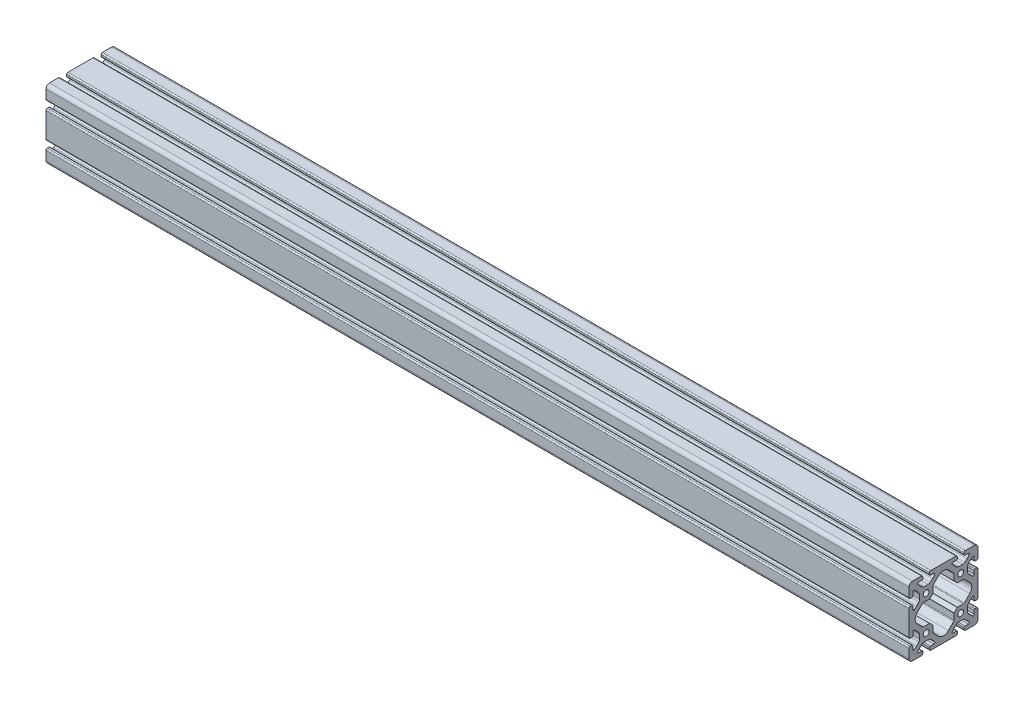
SolidWorks part; units mm, degrees
ref_plane "Ebene vorne" through (0, 0, 0) normal (0, 0, 1) x (1, 0, 0)
ref_plane "Ebene oben" through (0, 0, 0) normal (0, 1, 0) x (1, 0, 0)
ref_plane "Ebene rechts" through (0, 0, 0) normal (1, 0, 0) x (0, 0, -1)
sketch "Skizze1" plane through (0, 0, 0) normal (0, 1, 0) x (1, 0, 0)
  line L0 (0, 0) -> (1000, 0)
  dimension "D1" = 1000
other "Strukturbauteil1"
ref_plane "Ebene1" through (0, 0, 0) normal (1, 0, 0) x (0, 0, -1)
sketch "Model" plane through (0, 0, 0) normal (1, 0, 0) x (0, 0, -1)
  line L0 (-40, -25.5) -> (-40, -36)
  line L1 (-36, -40) -> (-25.5, -40)
  line L2 (-24, -38.5) -> (-24, -36.5)
  line L3 (-25, -35.5) -> (-28.9161, -35.5)
  line L4 (-22.1931, -27.75) -> (-17.8069, -27.75)
  line L5 (-11.0839, -35.5) -> (-15, -35.5)
  line L6 (-16, -36.5) -> (-16, -38.5)
  line L7 (-14.5, -40) -> (14.5, -40)
  line L8 (16, -38.5) -> (16, -36.5)
  line L9 (15, -35.5) -> (11.0839, -35.5)
  line L10 (17.8069, -27.75) -> (22.1931, -27.75)
  line L11 (28.9161, -35.5) -> (25, -35.5)
  line L12 (24, -36.5) -> (24, -38.5)
  line L13 (25.5, -40) -> (36, -40)
  line L14 (40, -36) -> (40, -25.5)
  line L15 (38.5, -24) -> (36.5, -24)
  line L16 (35.5, -25) -> (35.5, -28.9161)
  line L17 (27.75, -22.1931) -> (27.75, -17.8069)
  line L18 (35.5, -11.0839) -> (35.5, -15)
  line L19 (36.5, -16) -> (38.5, -16)
  line L20 (40, -14.5) -> (40, 14.5)
  line L21 (38.5, 16) -> (36.5, 16)
  line L22 (35.5, 15) -> (35.5, 11.0839)
  line L23 (27.75, 17.8069) -> (27.75, 22.1931)
  line L24 (35.5, 28.9161) -> (35.5, 25)
  line L25 (36.5, 24) -> (38.5, 24)
  line L26 (40, 25.5) -> (40, 36)
  line L27 (36, 40) -> (25.5, 40)
  line L28 (24, 38.5) -> (24, 36.5)
  line L29 (25, 35.5) -> (28.9161, 35.5)
  line L30 (22.1931, 27.75) -> (17.8069, 27.75)
  line L31 (11.0839, 35.5) -> (15, 35.5)
  line L32 (16, 36.5) -> (16, 38.5)
  line L33 (14.5, 40) -> (-14.5, 40)
  line L34 (-16, 38.5) -> (-16, 36.5)
  line L35 (-15, 35.5) -> (-11.0839, 35.5)
  line L36 (-17.8069, 27.75) -> (-22.1931, 27.75)
  line L37 (-28.9161, 35.5) -> (-25, 35.5)
  line L38 (-24, 36.5) -> (-24, 38.5)
  line L39 (-25.5, 40) -> (-36, 40)
  line L40 (-40, 36) -> (-40, 25.5)
  line L41 (-38.5, 24) -> (-36.5, 24)
  line L42 (-35.5, 25) -> (-35.5, 28.9161)
  line L43 (-27.75, 22.1931) -> (-27.75, 17.8069)
  line L44 (-35.5, 11.0839) -> (-35.5, 15)
  line L45 (-36.5, 16) -> (-38.5, 16)
  line L46 (-40, 14.5) -> (-40, -14.5)
  line L47 (-38.5, -16) -> (-36.5, -16)
  line L48 (-35.5, -15) -> (-35.5, -11.0839)
  line L49 (-27.75, -17.8069) -> (-27.75, -22.1931)
  line L50 (-35.5, -28.9161) -> (-35.5, -25)
  line L51 (-36.5, -24) -> (-38.5, -24)
  line L52 (-24.307, 11.8107) -> (-30.4608, 5.6569)
  line L53 (-30.4608, -5.6569) -> (-24.307, -11.8107)
  line L54 (-23.2463, -12.25) -> (-16.1585, -12.25)
  line L55 (-15.9464, -12.3379) -> (-12.3379, -15.9464)
  line L56 (-12.25, -16.1585) -> (-12.25, -23.2463)
  line L57 (-11.8107, -24.307) -> (-5.6569, -30.4608)
  line L58 (5.6569, -30.4608) -> (11.8107, -24.307)
  line L59 (12.25, -23.2463) -> (12.25, -16.1585)
  line L60 (12.3379, -15.9464) -> (15.9464, -12.3379)
  line L61 (16.1585, -12.25) -> (23.2463, -12.25)
  line L62 (24.307, -11.8107) -> (30.4608, -5.6569)
  line L63 (30.4608, 5.6569) -> (24.307, 11.8107)
  line L64 (23.2463, 12.25) -> (16.1585, 12.25)
  line L65 (15.9464, 12.3379) -> (12.3379, 15.9464)
  line L66 (12.25, 16.1585) -> (12.25, 23.2463)
  line L67 (11.8107, 24.307) -> (5.6569, 30.4608)
  line L68 (-5.6569, 30.4608) -> (-11.8107, 24.307)
  line L69 (-12.25, 23.2463) -> (-12.25, 16.1585)
  line L70 (-12.3379, 15.9464) -> (-15.9464, 12.3379)
  line L71 (-16.1585, 12.25) -> (-23.2463, 12.25)
  line L72 (-29.7888, 33.7733) -> (-27.3788, 30.9636)
  line L73 (-40, -40) -> (40, -40) construction
  line L74 (-40, -40) -> (-40, 40) construction
  line L75 (-40, 40) -> (40, 40) construction
  line L76 (40, -40) -> (40, 40) construction
  line L77 (-40, -40) -> (40, 40) construction
  line L78 (-40, 40) -> (40, -40) construction
  line L79 (-27.3788, 30.9636) -> (-24.5803, 28.5405)
  line L80 (-15.4197, 28.5405) -> (-12.6212, 30.9636)
  line L81 (-12.6212, 30.9636) -> (-10.2112, 33.7733)
  line L82 (-33.7733, 29.7888) -> (-30.9636, 27.3788)
  line L83 (-30.9636, 27.3788) -> (-28.5405, 24.5803)
  line L84 (10.2112, 33.7733) -> (12.6212, 30.9636)
  line L85 (12.6212, 30.9636) -> (15.4197, 28.5405)
  line L86 (24.5803, 28.5405) -> (27.3788, 30.9636)
  line L87 (27.3788, 30.9636) -> (29.7888, 33.7733)
  line L88 (33.7733, 29.7888) -> (30.9636, 27.3788)
  line L89 (30.9636, 27.3788) -> (28.5405, 24.5803)
  line L90 (28.5405, 15.4197) -> (30.9636, 12.6212)
  line L91 (30.9636, 12.6212) -> (33.7733, 10.2112)
  line L92 (33.7733, -10.2112) -> (30.9636, -12.6212)
  line L93 (30.9636, -12.6212) -> (28.5405, -15.4197)
  line L94 (28.5405, -24.5803) -> (30.9636, -27.3788)
  line L95 (30.9636, -27.3788) -> (33.7733, -29.7888)
  line L96 (29.7888, -33.7733) -> (27.3788, -30.9636)
  line L97 (27.3788, -30.9636) -> (24.5803, -28.5405)
  line L98 (15.4197, -28.5405) -> (12.6212, -30.9636)
  line L99 (12.6212, -30.9636) -> (10.2112, -33.7733)
  line L100 (-10.2112, -33.7733) -> (-12.6212, -30.9636)
  line L101 (-12.6212, -30.9636) -> (-15.4197, -28.5405)
  line L102 (-24.5803, -28.5405) -> (-27.3788, -30.9636)
  line L103 (-27.3788, -30.9636) -> (-29.7888, -33.7733)
  line L104 (-33.7733, -29.7888) -> (-30.9636, -27.3788)
  line L105 (-30.9636, -27.3788) -> (-28.5405, -24.5803)
  line L106 (-28.5405, -15.4197) -> (-30.9636, -12.6212)
  line L107 (-30.9636, -12.6212) -> (-33.7733, -10.2112)
  line L108 (-33.7733, 10.2112) -> (-30.9636, 12.6212)
  line L109 (-30.9636, 12.6212) -> (-28.5405, 15.4197)
  circle A0 centre (-20, -20) radius 3.4
  circle A1 centre (20, -20) radius 3.4
  circle A2 centre (-20, 20) radius 3.4
  circle A3 centre (20, 20) radius 3.4
  arc A4 (-40, -36) -> (-36, -40) centre (-36, -36) ccw
  arc A5 (-25.5, -40) -> (-24, -38.5) centre (-25.5, -38.5) ccw
  arc A6 (-24, -36.5) -> (-25, -35.5) centre (-25, -36.5) ccw
  arc A7 (-29.7888, -33.7733) -> (-28.9161, -35.5) centre (-28.9161, -34.4161) ccw
  arc A9 (-22.1931, -27.75) -> (-24.5803, -28.5405) centre (-22.1931, -31.75) ccw
  arc A10 (-15.4197, -28.5405) -> (-17.8069, -27.75) centre (-17.8069, -31.75) ccw
  arc A12 (-11.0839, -35.5) -> (-10.2112, -33.7733) centre (-11.0839, -34.4161) ccw
  arc A13 (-15, -35.5) -> (-16, -36.5) centre (-15, -36.5) ccw
  arc A14 (-16, -38.5) -> (-14.5, -40) centre (-14.5, -38.5) ccw
  arc A15 (14.5, -40) -> (16, -38.5) centre (14.5, -38.5) ccw
  arc A16 (16, -36.5) -> (15, -35.5) centre (15, -36.5) ccw
  arc A17 (10.2112, -33.7733) -> (11.0839, -35.5) centre (11.0839, -34.4161) ccw
  arc A19 (17.8069, -27.75) -> (15.4197, -28.5405) centre (17.8069, -31.75) ccw
  arc A20 (24.5803, -28.5405) -> (22.1931, -27.75) centre (22.1931, -31.75) ccw
  arc A22 (28.9161, -35.5) -> (29.7888, -33.7733) centre (28.9161, -34.4161) ccw
  arc A23 (25, -35.5) -> (24, -36.5) centre (25, -36.5) ccw
  arc A24 (24, -38.5) -> (25.5, -40) centre (25.5, -38.5) ccw
  arc A25 (36, -40) -> (40, -36) centre (36, -36) ccw
  arc A26 (40, -25.5) -> (38.5, -24) centre (38.5, -25.5) ccw
  arc A27 (36.5, -24) -> (35.5, -25) centre (36.5, -25) ccw
  arc A28 (33.7733, -29.7888) -> (35.5, -28.9161) centre (34.4161, -28.9161) ccw
  arc A30 (27.75, -22.1931) -> (28.5405, -24.5803) centre (31.75, -22.1931) ccw
  arc A31 (28.5405, -15.4197) -> (27.75, -17.8069) centre (31.75, -17.8069) ccw
  arc A33 (35.5, -11.0839) -> (33.7733, -10.2112) centre (34.4161, -11.0839) ccw
  arc A34 (35.5, -15) -> (36.5, -16) centre (36.5, -15) ccw
  arc A35 (38.5, -16) -> (40, -14.5) centre (38.5, -14.5) ccw
  arc A36 (40, 14.5) -> (38.5, 16) centre (38.5, 14.5) ccw
  arc A37 (36.5, 16) -> (35.5, 15) centre (36.5, 15) ccw
  arc A38 (33.7733, 10.2112) -> (35.5, 11.0839) centre (34.4161, 11.0839) ccw
  arc A40 (27.75, 17.8069) -> (28.5405, 15.4197) centre (31.75, 17.8069) ccw
  arc A41 (28.5405, 24.5803) -> (27.75, 22.1931) centre (31.75, 22.1931) ccw
  arc A43 (35.5, 28.9161) -> (33.7733, 29.7888) centre (34.4161, 28.9161) ccw
  arc A44 (35.5, 25) -> (36.5, 24) centre (36.5, 25) ccw
  arc A45 (38.5, 24) -> (40, 25.5) centre (38.5, 25.5) ccw
  arc A46 (40, 36) -> (36, 40) centre (36, 36) ccw
  arc A47 (25.5, 40) -> (24, 38.5) centre (25.5, 38.5) ccw
  arc A48 (24, 36.5) -> (25, 35.5) centre (25, 36.5) ccw
  arc A49 (29.7888, 33.7733) -> (28.9161, 35.5) centre (28.9161, 34.4161) ccw
  arc A51 (22.1931, 27.75) -> (24.5803, 28.5405) centre (22.1931, 31.75) ccw
  arc A52 (15.4197, 28.5405) -> (17.8069, 27.75) centre (17.8069, 31.75) ccw
  arc A54 (11.0839, 35.5) -> (10.2112, 33.7733) centre (11.0839, 34.4161) ccw
  arc A55 (15, 35.5) -> (16, 36.5) centre (15, 36.5) ccw
  arc A56 (16, 38.5) -> (14.5, 40) centre (14.5, 38.5) ccw
  arc A57 (-14.5, 40) -> (-16, 38.5) centre (-14.5, 38.5) ccw
  arc A58 (-16, 36.5) -> (-15, 35.5) centre (-15, 36.5) ccw
  arc A59 (-10.2112, 33.7733) -> (-11.0839, 35.5) centre (-11.0839, 34.4161) ccw
  arc A61 (-17.8069, 27.75) -> (-15.4197, 28.5405) centre (-17.8069, 31.75) ccw
  arc A62 (-24.5803, 28.5405) -> (-22.1931, 27.75) centre (-22.1931, 31.75) ccw
  arc A64 (-28.9161, 35.5) -> (-29.7888, 33.7733) centre (-28.9161, 34.4161) ccw
  arc A65 (-25, 35.5) -> (-24, 36.5) centre (-25, 36.5) ccw
  arc A66 (-24, 38.5) -> (-25.5, 40) centre (-25.5, 38.5) ccw
  arc A67 (-36, 40) -> (-40, 36) centre (-36, 36) ccw
  arc A68 (-40, 25.5) -> (-38.5, 24) centre (-38.5, 25.5) ccw
  arc A69 (-36.5, 24) -> (-35.5, 25) centre (-36.5, 25) ccw
  arc A70 (-33.7733, 29.7888) -> (-35.5, 28.9161) centre (-34.4161, 28.9161) ccw
  arc A72 (-27.75, 22.1931) -> (-28.5405, 24.5803) centre (-31.75, 22.1931) ccw
  arc A73 (-28.5405, 15.4197) -> (-27.75, 17.8069) centre (-31.75, 17.8069) ccw
  arc A75 (-35.5, 11.0839) -> (-33.7733, 10.2112) centre (-34.4161, 11.0839) ccw
  arc A76 (-35.5, 15) -> (-36.5, 16) centre (-36.5, 15) ccw
  arc A77 (-38.5, 16) -> (-40, 14.5) centre (-38.5, 14.5) ccw
  arc A78 (-40, -14.5) -> (-38.5, -16) centre (-38.5, -14.5) ccw
  arc A79 (-36.5, -16) -> (-35.5, -15) centre (-36.5, -15) ccw
  arc A80 (-33.7733, -10.2112) -> (-35.5, -11.0839) centre (-34.4161, -11.0839) ccw
  arc A82 (-27.75, -17.8069) -> (-28.5405, -15.4197) centre (-31.75, -17.8069) ccw
  arc A83 (-28.5405, -24.5803) -> (-27.75, -22.1931) centre (-31.75, -22.1931) ccw
  arc A85 (-35.5, -28.9161) -> (-33.7733, -29.7888) centre (-34.4161, -28.9161) ccw
  arc A86 (-35.5, -25) -> (-36.5, -24) centre (-36.5, -25) ccw
  arc A87 (-38.5, -24) -> (-40, -25.5) centre (-38.5, -25.5) ccw
  arc A88 (-30.4608, 5.6569) -> (-30.4608, -5.6569) centre (-24.8039, 0) ccw
  arc A89 (-24.307, -11.8107) -> (-23.2463, -12.25) centre (-23.2463, -10.75) ccw
  arc A90 (-15.9464, -12.3379) -> (-16.1585, -12.25) centre (-16.1585, -12.55) ccw
  arc A91 (-12.25, -16.1585) -> (-12.3379, -15.9464) centre (-12.55, -16.1585) ccw
  arc A92 (-12.25, -23.2463) -> (-11.8107, -24.307) centre (-10.75, -23.2463) ccw
  arc A93 (-5.6569, -30.4608) -> (5.6569, -30.4608) centre (0, -24.8039) ccw
  arc A94 (11.8107, -24.307) -> (12.25, -23.2463) centre (10.75, -23.2463) ccw
  arc A95 (12.3379, -15.9464) -> (12.25, -16.1585) centre (12.55, -16.1585) ccw
  arc A96 (16.1585, -12.25) -> (15.9464, -12.3379) centre (16.1585, -12.55) ccw
  arc A97 (23.2463, -12.25) -> (24.307, -11.8107) centre (23.2463, -10.75) ccw
  arc A98 (30.4608, -5.6569) -> (30.4608, 5.6569) centre (24.8039, 0) ccw
  arc A99 (24.307, 11.8107) -> (23.2463, 12.25) centre (23.2463, 10.75) ccw
  arc A100 (15.9464, 12.3379) -> (16.1585, 12.25) centre (16.1585, 12.55) ccw
  arc A101 (12.25, 16.1585) -> (12.3379, 15.9464) centre (12.55, 16.1585) ccw
  arc A102 (12.25, 23.2463) -> (11.8107, 24.307) centre (10.75, 23.2463) ccw
  arc A103 (5.6569, 30.4608) -> (-5.6569, 30.4608) centre (0, 24.8039) ccw
  arc A104 (-11.8107, 24.307) -> (-12.25, 23.2463) centre (-10.75, 23.2463) ccw
  arc A105 (-12.3379, 15.9464) -> (-12.25, 16.1585) centre (-12.55, 16.1585) ccw
  arc A106 (-16.1585, 12.25) -> (-15.9464, 12.3379) centre (-16.1585, 12.55) ccw
  arc A107 (-23.2463, 12.25) -> (-24.307, 11.8107) centre (-23.2463, 10.75) ccw
  point P20 (0, 0)
  point P288 (0, 0)
  point P294 (-40, 20)
  point P295 (-40, 0)
  point P296 (-40, -20)
  point P297 (-20, -40)
  point P298 (0, -40)
  point P299 (20, -40)
  point P300 (40, -20)
  point P301 (40, 0)
  point P302 (40, 20)
  point P303 (20, 40)
  point P304 (0, 40)
  point P305 (-20, 40)
